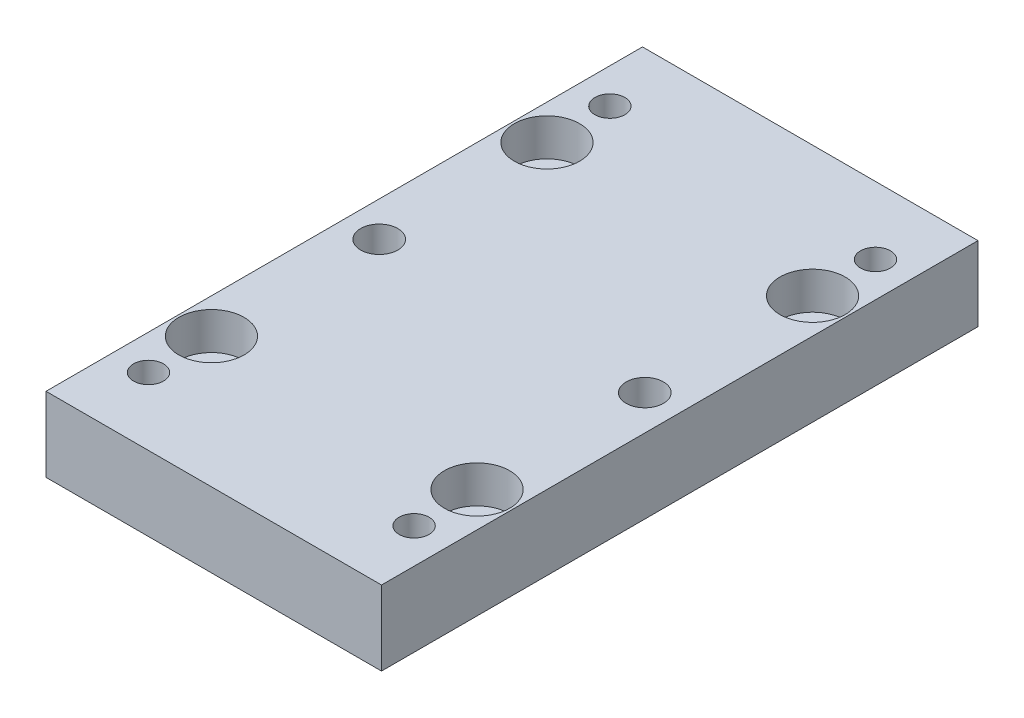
SolidWorks part; units mm, degrees
ref_plane "Front Plane" through (0, 0, 0) normal (0, 0, 1) x (1, 0, 0)
ref_plane "Top Plane" through (0, 0, 0) normal (0, 1, 0) x (1, 0, 0)
ref_plane "Right Plane" through (0, 0, 0) normal (1, 0, 0) x (0, 0, -1)
sketch "Sketch1" plane through (0, 0, 0) normal (0, 1, 0) x (1, 0, 0)
  line L1 (-28.575, 50.8) -> (28.575, 50.8)
  line L2 (-28.575, 50.8) -> (-28.575, -50.8)
  line L3 (-28.575, -50.8) -> (28.575, -50.8)
  line L4 (28.575, 50.8) -> (28.575, -50.8)
  line L5 (-28.575, 50.8) -> (28.575, -50.8) construction
  line L6 (-28.575, -50.8) -> (28.575, 50.8) construction
  point P0 (0, 0)
  dimension "D1" = 57.15
  dimension "D2" = 101.6
extrude "Boss-Extrude1" add sketch "Sketch1" along normal blind 12.7
hole_wizard "CBORE for 1/4 Socket Head Cap Screw1" positions "Sketch2" profile "Sketch3" counterbore size "1/4" standard "ANSI Inch"
sketch "Sketch2" plane through (0, 12.7, 0) normal (0, 1, 0) x (1, 0, 0)
  point P0 (22.6187, -28.575)
  point P3 (22.6187, 28.575)
  point P6 (-22.6187, 28.575)
  point P9 (-22.6187, -28.575)
sketch "Sketch3" plane through (22.6187, 12.7, 28.575) normal (1, 0, 0) x (0, 0, 1)
  line L0 (0, 0) -> (0, 12.7)
  line L1 (0, 12.7) -> (3.3782, 12.7)
  line L3 (3.3782, 12.7) -> (3.3782, 6.35)
  line L4 (3.3782, 6.35) -> (5.5562, 6.35)
  line L5 (5.5562, 6.35) -> (5.5563, 0)
  line L7 (5.5563, 0) -> (0, 0)
  line L11 (0, -6.35) -> (0, 107.95) construction
  dimension "Thru Hole Dia." = 6.7564
  dimension "Thru Hole Depth" = 12.7
  dimension "C'Bore Dia." = 11.1125
  dimension "C'Bore Depth" = 6.35
hole_wizard "1/4 (0.2500) Dowel Hole1" positions "Sketch4" profile "Sketch5" hole size "1/4" standard "ANSI Inch"
sketch "Sketch4" plane through (0, 12.7, 0) normal (0, 1, 0) x (1, 0, 0)
  point P0 (22.6187, 0)
  point P3 (-22.6187, 0)
sketch "Sketch5" plane through (22.6187, 12.7, 0) normal (1, 0, 0) x (0, 0, 1)
  line L0 (0, 0) -> (0, 12.7)
  line L1 (0, 12.7) -> (3.175, 12.7)
  line L2 (3.175, 12.7) -> (3.175, 0)
  line L5 (3.175, 0) -> (0, 0)
  line L11 (0, -6.35) -> (0, 107.95) construction
  dimension "Thru Hole Dia." = 6.35
  dimension "Thru Hole Depth" = 12.7
hole_wizard "1/4-20 Tapped Hole1" positions "Sketch6" profile "Sketch7" tap size "1/4-20" standard "ANSI Inch"
sketch "Sketch6" plane through (0, 12.7, 0) normal (0, 1, 0) x (1, 0, 0)
  point P0 (-22.6187, -39.2938)
  point P3 (22.6187, -39.2938)
  point P6 (-22.6187, 39.2938)
  point P8 (22.6187, 39.2938)
sketch "Sketch7" plane through (-22.6187, 12.7, 39.2938) normal (1, 0, 0) x (0, 0, 1)
  line L0 (0, 0) -> (0, 12.7)
  line L1 (0, 12.7) -> (2.5527, 12.7)
  line L2 (2.5527, 12.7) -> (2.5527, 0)
  line L5 (2.5527, 0) -> (0, 0)
  line L11 (0, -6.35) -> (0, 107.95) construction
  dimension "Thru Tap Drill Dia." = 5.1054
  dimension "Thru Tap Drill Depth" = 12.7
